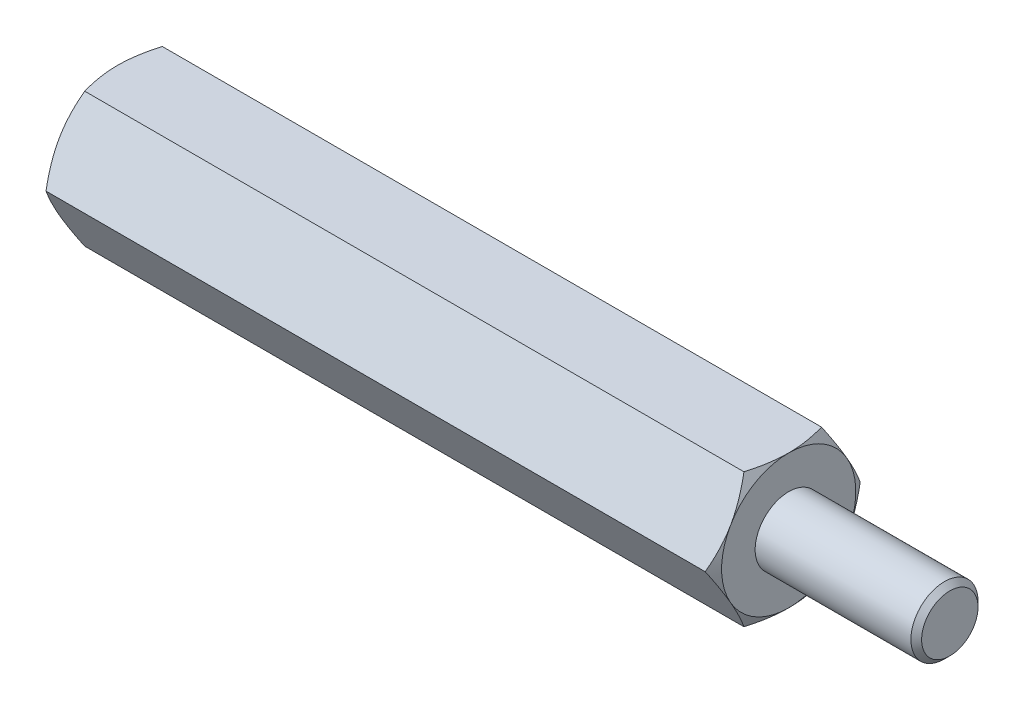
SolidWorks part; units mm, degrees
ref_plane "Front Plane" through (0, 0, 0) normal (0, 0, 1) x (1, 0, 0)
ref_plane "Top Plane" through (0, 0, 0) normal (0, 1, 0) x (1, 0, 0)
ref_plane "Right Plane" through (0, 0, 0) normal (1, 0, 0) x (0, 0, -1)
sketch "Sketch1" plane through (0, 0, 0) normal (1, 0, 0) x (0, 0, -1)
  line L1 (1.4434, 2.5) -> (-1.4434, 2.5)
  line L2 (-1.4434, 2.5) -> (-2.8868, 0)
  line L3 (-2.8868, 0) -> (-1.4434, -2.5)
  line L4 (-1.4434, -2.5) -> (1.4434, -2.5)
  line L5 (1.4434, -2.5) -> (2.8868, 0)
  line L6 (2.8868, 0) -> (1.4434, 2.5)
  circle A0 centre (0, 0) radius 2.5 construction
  dimension "D1" = 5
extrude "Extrude2" add sketch "Sketch1" along normal mid plane 25
sketch "Sketch2" plane through (0, 0, 0) normal (0, 0, 1) x (1, 0, 0)
  line L0 (-12.5, 2.5) -> (-11, 5.0981)
  line L1 (-12.5, 5.5) -> (-12.5, 2.5)
  line L3 (0, 0) -> (50000, 0) construction
  arc A0 (-11, 5.0981) -> (-12.5, 5.5) centre (-11.6962, 5.5) ccw
  dimension "D1" = 30
  dimension "D2" = 3
revolve "Cut-Revolve1" cut sketch "Sketch2" angle 360 about L3
mirror "Mirror1" about plane through (0, 0, 0) normal (1, 0, 0) of "Cut-Revolve1"
sketch "Sketch3" plane through (-12.5, 0, 0) normal (-1, 0, 0) x (0, 0, 1)
  circle A0 centre (0, 0) radius 1.05
  dimension "D1" = 2.1
extrude "Extrude3" cut sketch "Sketch3" against normal blind 6
sketch "Sketch4" plane through (0, 0, 0) normal (0, 0, 1) x (1, 0, 0)
  line L0 (-6.5, 0) -> (-6.5, 1.05)
  line L1 (12.2767, 0) -> (-12.2767, 0) construction
  line L2 (-6.5, 1.05) -> (-5.8938, 0)
  line L3 (-5.8938, 0) -> (-6.5, 0)
  line L4 (-12.5, 1.25) -> (-12.5, -1.25) construction
  point P4 (-12.5, 0)
  dimension "D1" = 30
  dimension "D2" = 1.05
  dimension "D3" = 6
revolve "Cut-Revolve2" cut sketch "Sketch4" angle 360 about L3
sketch "Sketch5" plane through (12.5, 0, 0) normal (1, 0, 0) x (0, 0, -1)
  circle A0 centre (0, 0) radius 1.25
  dimension "D1" = 2.5
extrude "Extrude4" add sketch "Sketch5" along normal blind 6
chamfer "Chamfer1" distance 0.2 angle 45 1 edges at (18.5, 0, -1.25)
equation "\"D2@Sketch4\" = \"D1@Sketch3\"/2"
